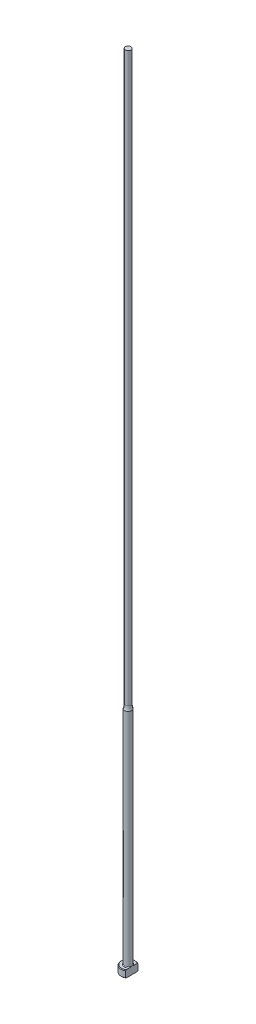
SolidWorks part; units mm, degrees
ref_plane "Front Plane" through (0, 0, 0) normal (0, 0, 1) x (1, 0, 0)
ref_plane "Top Plane" through (0, 0, 0) normal (0, 1, 0) x (1, 0, 0)
ref_plane "Right Plane" through (0, 0, 0) normal (1, 0, 0) x (0, 0, -1)
sketch "Sketch1" plane through (0, 0, 0) normal (0, 0, 1) x (1, 0, 0)
  line L0 (0, 259.9588) -> (0, -15.1925) construction
  line L1 (0, 0) -> (-3.175, 0)
  line L2 (-3.175, 0) -> (-3.175, 3.175)
  line L3 (-3.175, 3.175) -> (-1.5875, 3.175)
  line L4 (-1.2535, 103.6323) -> (-1.2535, 355.6)
  line L5 (-1.2535, 355.6) -> (0, 355.6)
  line L6 (0, 355.6) -> (0, 0)
  line L7 (-1.5875, 3.175) -> (-1.5875, 101.6)
  arc A0 (-1.5875, 101.6) -> (-1.2535, 103.6323) centre (-7.6035, 103.6323) ccw
  point P13 (-1.5875, 0)
  dimension "D1" = 6.35
  dimension "L" = 355.6
  dimension "D2" = 3.175
  dimension "H" = 6.35
  dimension "T" = 3.175
  dimension "D" = 2.507
  dimension "S" = 101.6
revolve "Revolve1" add sketch "Sketch1" angle 360 about L0
chamfer "Chamfer1" distance 0.254 angle 45 2 edges at (0, 3.175, 3.175) (0, 0, 3.175)
fillet "Fillet1" radius 0.254 1 edges at (0, 3.175, 1.5875)
sketch "Sketch2" plane through (0, 0, 0) normal (0, 1, 0) x (1, 0, 0)
  line L0 (1.5875, -2.7496) -> (1.5875, 2.7496)
  circle A0 centre (0, 0) radius 3.175 construction
  arc A2 (1.5875, -2.7496) -> (1.5875, 2.7496) centre (0, 0) ccw
  circle A3 centre (0, 0) radius 3.175 construction
  circle A4 centre (0, 0) radius 1.5875 construction
extrude "Key Head" cut sketch "Sketch2" along normal up to next
